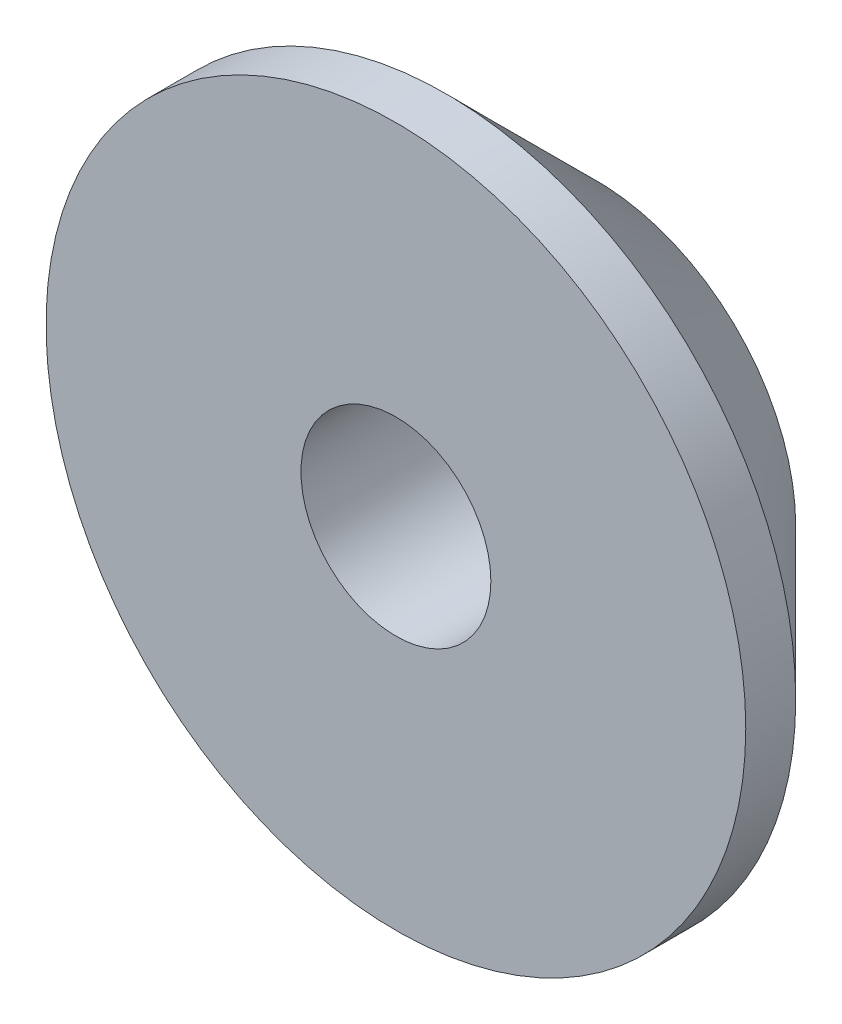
SolidWorks part; units mm, degrees
ref_plane "Plan de face" through (0, 0, 0) normal (0, 0, 1) x (1, 0, 0)
ref_plane "Plan de dessus" through (0, 0, 0) normal (0, 1, 0) x (1, 0, 0)
ref_plane "Plan de droite" through (0, 0, 0) normal (1, 0, 0) x (0, 0, -1)
sketch "Esquisse1" plane through (0, 0, 0) normal (0, 0, 1) x (1, 0, 0)
  circle A0 centre (0, 0) radius 0.95
  circle A1 centre (0, 0) radius 3.5
extrude "Extrusion1" add sketch "Esquisse1" along normal blind 2
chamfer "Chanfrein1" distance 1.5 distance2 1.5 1 edges at (3.5, 0, 0)
